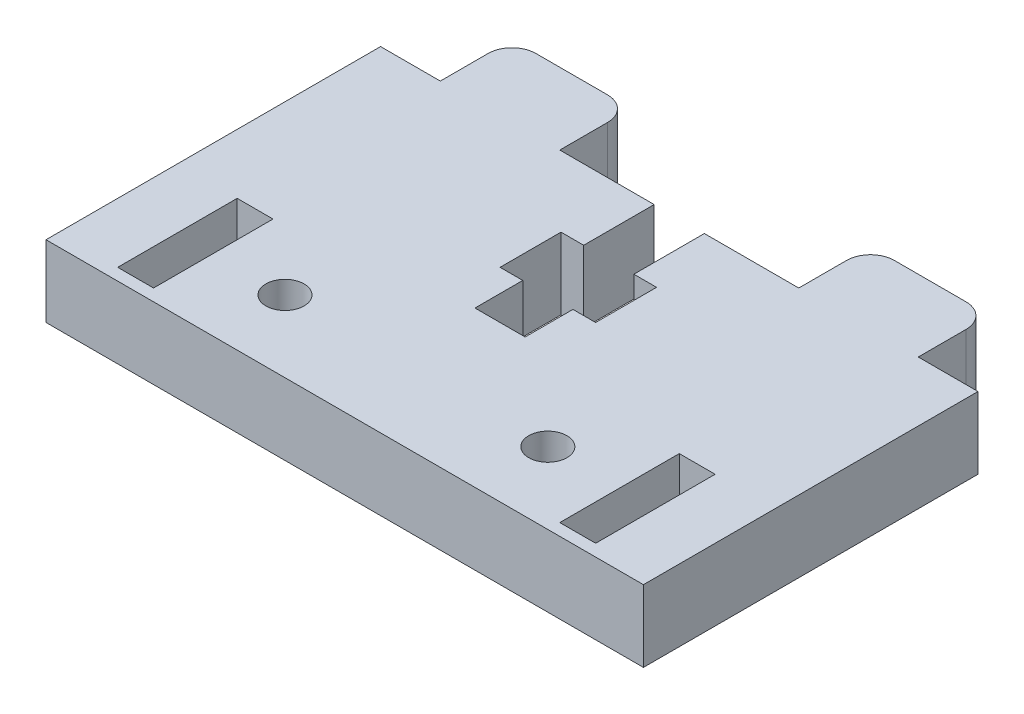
SolidWorks part; units mm, degrees
ref_plane "Спереди" through (0, 0, 0) normal (0, 0, 1) x (1, 0, 0)
ref_plane "Сверху" through (0, 0, 0) normal (0, 1, 0) x (1, 0, 0)
ref_plane "Справа" through (0, 0, 0) normal (1, 0, 0) x (0, 0, -1)
sketch "Эскиз1" plane through (0, 0, 0) normal (0, 1, 0) x (1, 0, 0)
  line L1 (0, 0) -> (50, 0)
  line L2 (0, 0) -> (0, 28)
  line L3 (0, 28) -> (50, 28)
  line L4 (50, 0) -> (50, 28)
  line L5 (5, 28) -> (15, 28)
  line L6 (5, 28) -> (5, 32)
  line L7 (7, 34) -> (13, 34)
  line L8 (15, 28) -> (15, 32)
  line L9 (35, 28) -> (45, 28)
  line L10 (35, 28) -> (35, 32)
  line L11 (37, 34) -> (43, 34)
  line L12 (45, 28) -> (45, 32)
  line L13 (22.9, 28) -> (27.1, 28)
  line L14 (22.9, 28) -> (22.9, 13)
  line L15 (22.9, 13) -> (27.1, 13)
  line L16 (27.1, 28) -> (27.1, 13)
  line L17 (21, 22.1) -> (29, 22.1)
  line L18 (21, 22.1) -> (21, 17)
  line L19 (21, 17) -> (29, 17)
  line L20 (29, 22.1) -> (29, 17)
  line L21 (5, 11) -> (8, 11)
  line L22 (5, 11) -> (5, 1)
  line L23 (5, 1) -> (8, 1)
  line L24 (8, 11) -> (8, 1)
  line L25 (42, 11) -> (45, 11)
  line L26 (42, 11) -> (42, 1)
  line L27 (42, 1) -> (45, 1)
  line L28 (45, 11) -> (45, 1)
  circle A0 centre (14, 6) radius 1.6
  circle A1 centre (36, 6) radius 1.6
  arc A2 (43, 34) -> (45, 32) centre (43, 32) cw
  arc A3 (35, 32) -> (37, 34) centre (37, 32) cw
  arc A4 (13, 34) -> (15, 32) centre (13, 32) cw
  arc A5 (5, 32) -> (7, 34) centre (7, 32) cw
  point P21 (25, 17)
  point P22 (25, 13)
  point P35 (8, 6)
  point P38 (45, 34)
  point P41 (35, 34)
  point P44 (15, 34)
  point P47 (5, 34)
extrude "Бобышка-Вытянуть1" add sketch "Эскиз1" along normal blind 6 contours A3 L10 L3 L12 A2 L11 | L17 L20 L19 L16 L15 L14 L18 L3 L2 L1 L4 A1 A0 L21 L24 L23 L22 L25 L28 L27 L26 | L7 A4 L8 L5 L6 A5
equation "\"D13@Эскиз1\"=\"D5@Эскиз1\"/2"
